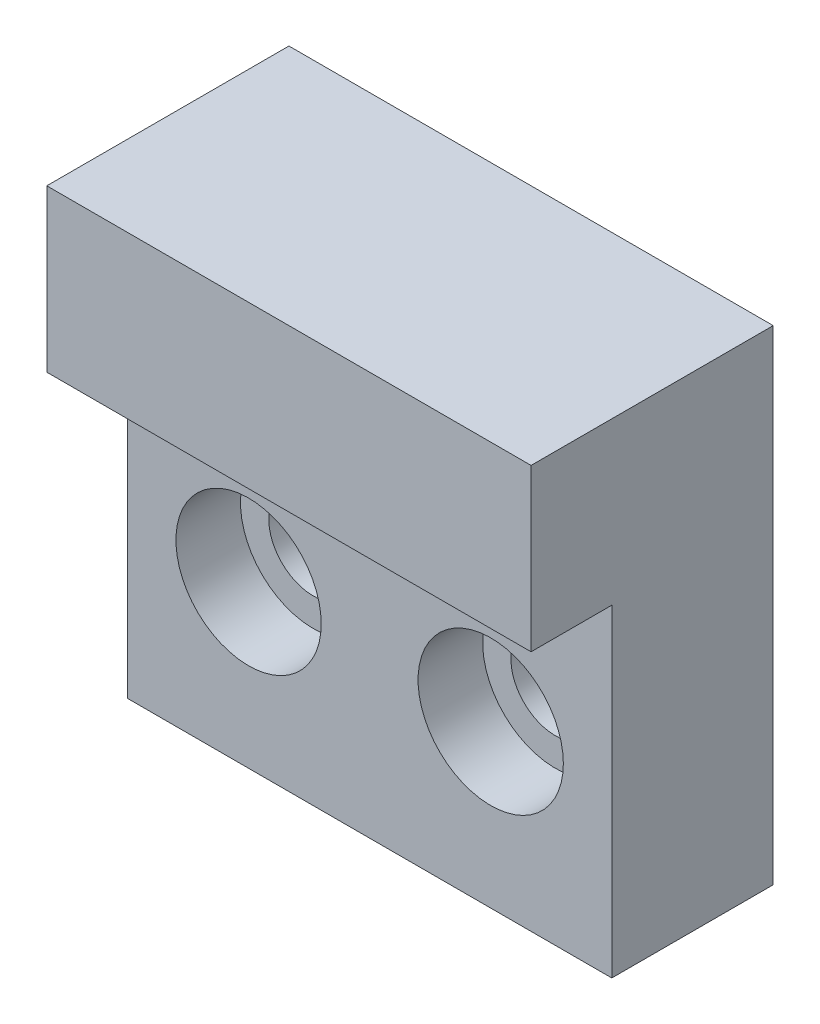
SolidWorks part; units mm, degrees
ref_plane "Plan de face" through (0, 0, 0) normal (0, 0, 1) x (1, 0, 0)
ref_plane "Plan de dessus" through (0, 0, 0) normal (0, 1, 0) x (1, 0, 0)
ref_plane "Plan de droite" through (0, 0, 0) normal (1, 0, 0) x (0, 0, -1)
sketch "Esquisse1" plane through (0, 0, 0) normal (1, 0, 0) x (0, 0, -1)
  line L0 (0, 0) -> (0, 30)
  line L1 (0, 30) -> (-15, 30)
  line L2 (-15, 30) -> (-15, 20)
  line L3 (-15, 20) -> (-10, 20)
  line L4 (-10, 20) -> (-10, 0)
  line L5 (-10, 0) -> (0, 0)
  dimension "D1" = 10
  dimension "D2" = 15
  dimension "D3" = 10
  dimension "D4" = 20
extrude "Boss.-Extru.1" add sketch "Esquisse1" along normal blind 30
sketch "Esquisse2" plane through (0, 0, 10) normal (0, 0, 1) x (1, 0, 0)
  line L0 (30, 20) -> (30, 0) construction
  line L1 (30, 0) -> (0, 0) construction
  circle A0 centre (7.5, 10) radius 4.5
  circle A1 centre (22.5, 10) radius 4.5
  dimension "D1" = 9
  dimension "D2" = 9
  dimension "D4" = 7.5
  dimension "D5" = 10
  dimension "D6" = 10
  dimension "D3" = 15
extrude "Enlèv. mat.-Extru.1" cut sketch "Esquisse2" against normal blind 4
sketch "Esquisse3" plane through (0, 0, 6) normal (0, 0, 1) x (1, 0, 0)
  circle A0 centre (22.5, 10) radius 2.75
  circle A1 centre (7.5, 10) radius 2.75
  dimension "D1" = 5.5
  dimension "D2" = 5.5
extrude "Enlèv. mat.-Extru.2" cut sketch "Esquisse3" against normal blind 9
